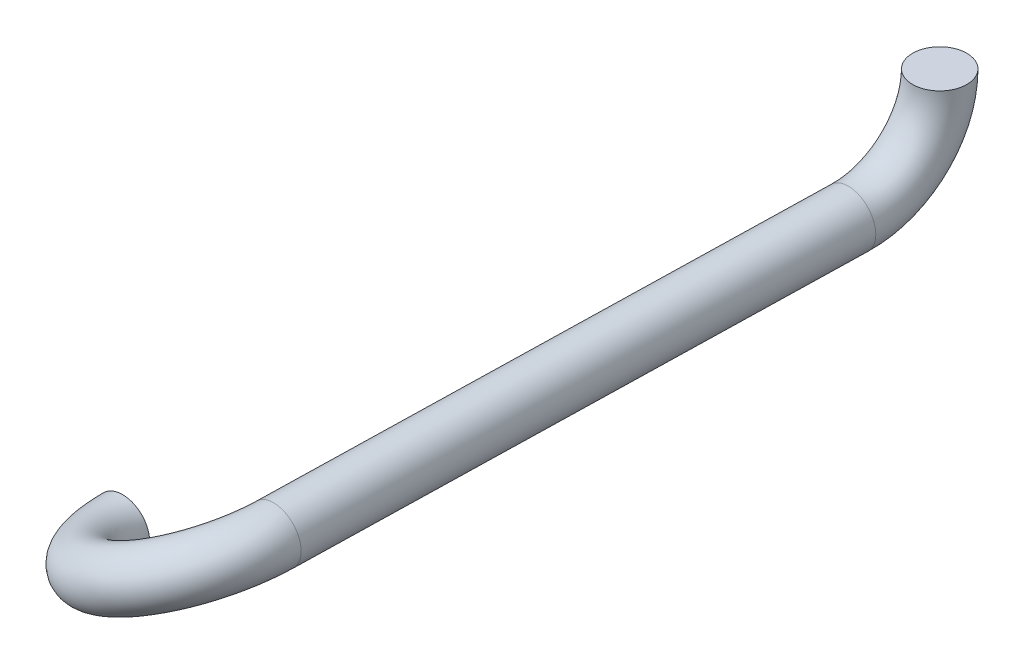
SolidWorks part; units mm, degrees
ref_plane "Front Plane" through (0, 0, 0) normal (0, 0, 1) x (1, 0, 0)
ref_plane "Top Plane" through (0, 0, 0) normal (0, 1, 0) x (1, 0, 0)
ref_plane "Right Plane" through (0, 0, 0) normal (1, 0, 0) x (0, 0, -1)
sketch3d "3DSketch1"
  line L0 (0, 0, 0) -> (0, 0, -17.3027) construction
  line L1 (27.1475, 25.273, -92.6338) -> (27.1475, 40.3529, -92.6338) construction
  point P0 (0, 0, 0)
  point P1 (27.1475, 25.273, -92.6338)
sketch "Sketch2" plane through (0, 0, 0) normal (0, 0, 1) x (1, 0, 0)
  circle A0 centre (0, 0) radius 3.9688
  dimension "D1" = 7.9375
ref_plane "Plane2" through (0, 0, 0) normal (0.4226, -0.9063, 0) x (0.9063, 0.4226, 0)
sketch3d "3DSketch6"
  line L0 (0, 0, 0) -> (0, 0, -17.3027) construction
  line L1 (27.1475, 12.6591, -92.6338) -> (23.0064, 10.7281, 0.6215) construction
  arc A0 (0, 0, 0) -> (23.0064, 10.7281, 0.6215) centre (11.5101, 5.3673, 0) ccw
  point P5 (6.1429, 16.8774, 0)
  dimension "D1" = 12.7
ref_plane "Plane4" through (22.9887, 0, 1.0208) normal (-0.999, 0, -0.0444) x (-0.0444, 0, 0.999)
sketch3d "3DSketch7"
  line L0 (27.1475, 25.273, -92.6338) -> (27.1475, 40.3529, -92.6338) construction
  line L1 (27.1475, 12.6591, -92.6338) -> (23.0064, 10.7281, 0.6215) construction
  line L2 (0, 0, 0) -> (0, 0, -17.3027) construction
  line L3 (26.5881, 12.3982, -80.035) -> (23.0064, 10.7281, 0.6215)
  arc A0 (27.1475, 25.273, -92.6338) -> (26.5881, 12.3982, -80.035) centre (26.5762, 25.273, -79.7689) ccw
  arc A1 (0, 0, 0) -> (23.0064, 10.7281, 0.6215) centre (11.5101, 5.3673, 0) ccw
  point P5 (13.7114, 25.273, -80.3402)
  point P14 (6.1429, 16.8774, 0)
sweep "Sweep2" add profiles "Sketch2" path "3DSketch7"
